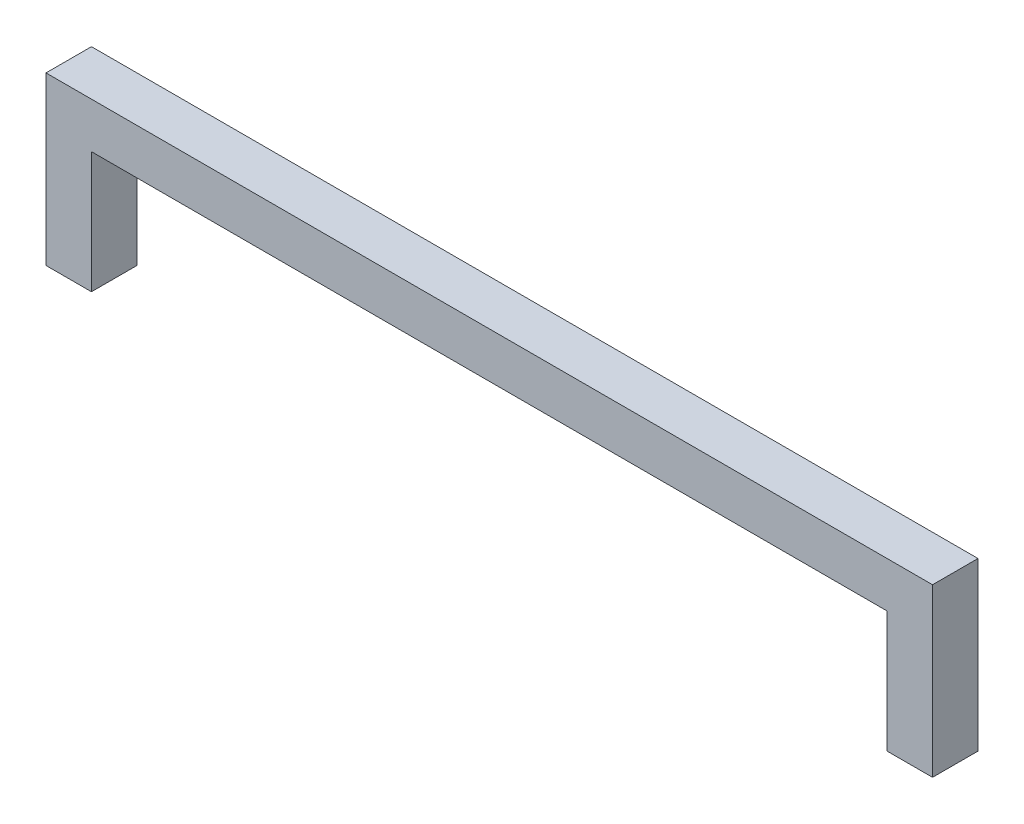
SolidWorks part; units mm, degrees
ref_plane "Piano frontale" through (0, 0, 0) normal (0, 0, 1) x (1, 0, 0)
ref_plane "Piano superiore" through (0, 0, 0) normal (0, 1, 0) x (1, 0, 0)
ref_plane "Piano destro" through (0, 0, 0) normal (1, 0, 0) x (0, 0, -1)
sketch "Schizzo1" plane through (0, 0, 0) normal (0, 0, 1) x (1, 0, 0)
  line L0 (0, 0) -> (0, 106.77)
  line L1 (0, 106.77) -> (700, 106.77)
  line L2 (700, 106.77) -> (700, 0)
  dimension "D1" = 106.77
  dimension "D2" = 700
sketch "Schizzo2" plane through (0, 0, 0) normal (0, 1, 0) x (1, 0, 0)
  line L1 (0, 0) -> (-40, 0)
  line L2 (0, 0) -> (0, -40)
  line L3 (0, -40) -> (-40, -40)
  line L4 (-40, 0) -> (-40, -40)
  dimension "D1" = 40
  dimension "D2" = 40
sweep "Sweep-Sottile1" add profiles "Schizzo2" path "Schizzo1" parameters "D1"=1
ref_plane "Piano1" through (350, 0, 0) normal (-1, 0, 0) x (0, 0, 1)
